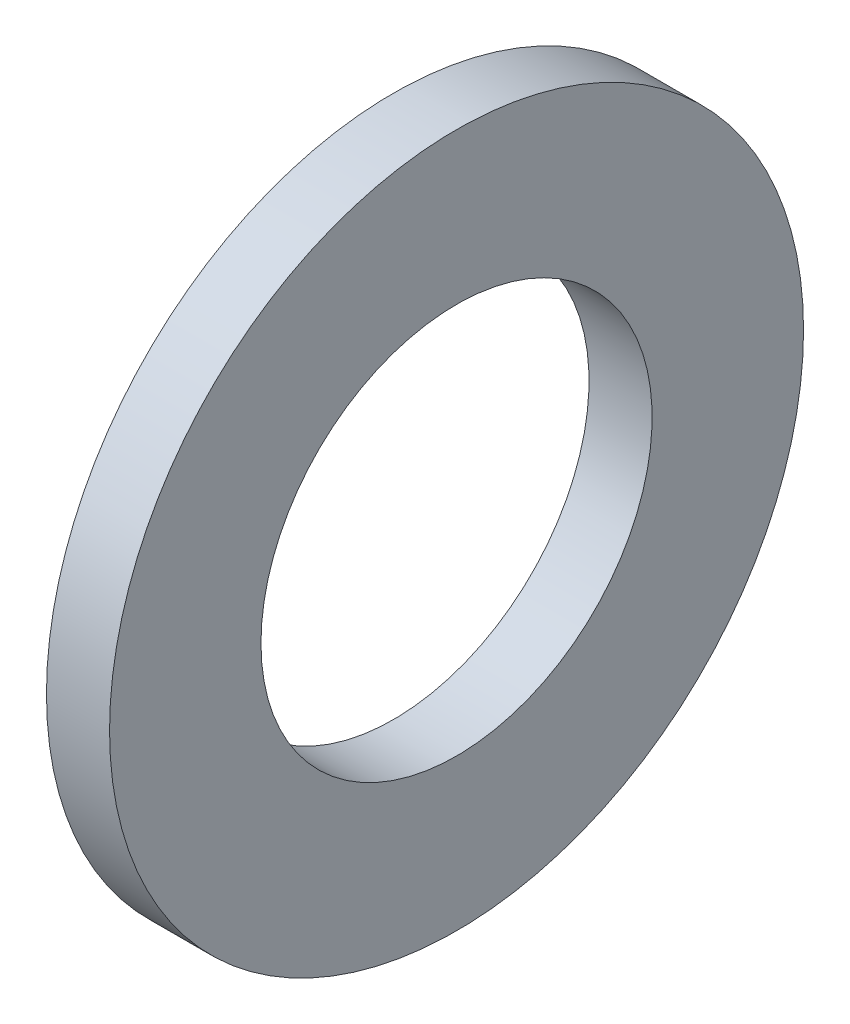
SolidWorks part; units mm, degrees
ref_plane "Plan de face" through (0, 0, 0) normal (0, 0, 1) x (1, 0, 0)
ref_plane "Plan de dessus" through (0, 0, 0) normal (0, 1, 0) x (1, 0, 0)
ref_plane "Plan de droite" through (0, 0, 0) normal (1, 0, 0) x (0, 0, -1)
sketch "Esquisse1" plane through (0, 0, 0) normal (0, 0, 1) x (1, 0, 0)
  line L0 (5, 27.5) -> (0, 27.5)
  line L1 (0, 27.5) -> (0, 15.5)
  line L3 (5, 15.5) -> (0, 15.5)
  line L5 (5, 27.5) -> (5, 15.5)
  line L6 (-6.4794, 0) -> (22.4216, 0) construction
revolve "Révolution1" add sketch "Esquisse1" angle 360 about L6
